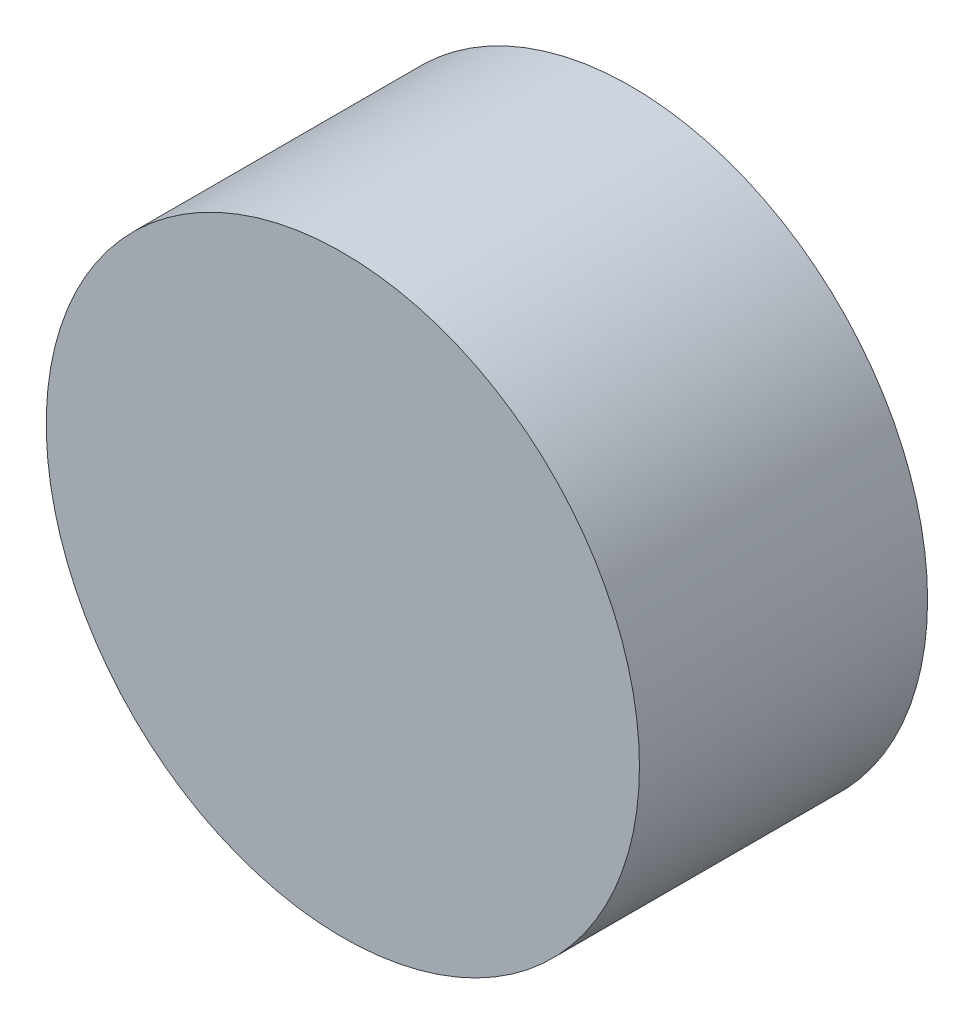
SolidWorks part; units mm, degrees
ref_plane "Front Plane" through (0, 0, 0) normal (0, 0, 1) x (1, 0, 0)
ref_plane "Top Plane" through (0, 0, 0) normal (0, 1, 0) x (1, 0, 0)
ref_plane "Right Plane" through (0, 0, 0) normal (1, 0, 0) x (0, 0, -1)
sketch "Sketch1" plane through (0, 0, 0) normal (0, 0, 1) x (1, 0, 0)
  circle A0 centre (0, 0) radius 22.225
  dimension "D1" = 44.45
extrude "Boss-Extrude1" add sketch "Sketch1" along normal mid plane 21.59
